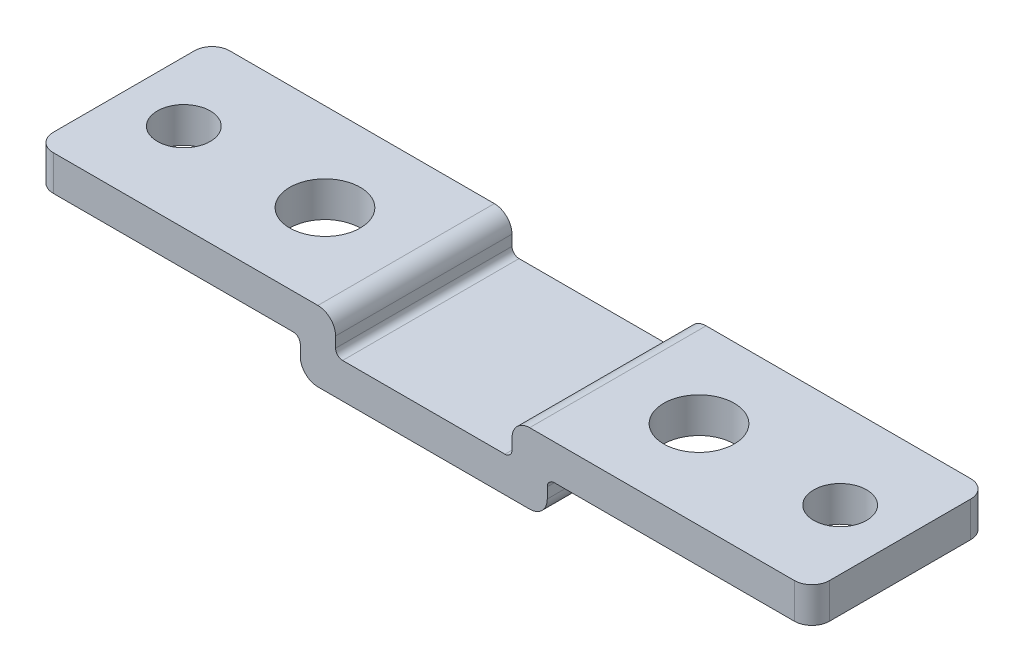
SolidWorks part; units mm, degrees
ref_plane "Plan de face" through (0, 0, 0) normal (0, 0, 1) x (1, 0, 0)
ref_plane "Plan de dessus" through (0, 0, 0) normal (0, 1, 0) x (1, 0, 0)
ref_plane "Plan de droite" through (0, 0, 0) normal (1, 0, 0) x (0, 0, -1)
sketch "Esquisse1" plane through (0, 0, 0) normal (0, 0, 1) x (1, 0, 0)
  line L0 (-13.3273, 2.7875) -> (-16.3273, 2.7875)
  line L1 (-16.8273, 3.2875) -> (-16.8273, 3.5875)
  line L2 (-17.0273, 3.7875) -> (-24.3273, 3.7875)
  line L3 (-24.3273, 3.7875) -> (-24.3273, 4.7875)
  line L4 (-24.3273, 4.7875) -> (-16.3273, 4.7875)
  line L5 (-15.8273, 4.2875) -> (-15.8273, 3.9875)
  line L6 (-15.6273, 3.7875) -> (-13.3273, 3.7875)
  line L7 (-13.3273, 3.7875) -> (-13.3273, 2.7875)
  arc A0 (-15.8273, 3.9875) -> (-15.6273, 3.7875) centre (-15.6273, 3.9875) ccw
  arc A1 (-16.8273, 3.5875) -> (-17.0273, 3.7875) centre (-17.0273, 3.5875) ccw
  arc A2 (-16.3273, 4.7875) -> (-15.8273, 4.2875) centre (-16.3273, 4.2875) cw
  arc A3 (-16.3273, 2.7875) -> (-16.8273, 3.2875) centre (-16.3273, 3.2875) cw
  dimension "D7" = 0.2
  dimension "D8" = 0.2
  dimension "D9" = 0.5
  dimension "D1" = 1
  dimension "D2" = 1
  dimension "D3" = 1
  dimension "D4" = 2.5
  dimension "D5" = 11
  dimension "D6" = 2
extrude "Extrusion1" add sketch "Esquisse1" along normal blind 5
fillet "Congé1" radius 0.5 2 edges at (-24.3273, 4.2875, 5) (-24.3273, 4.2875, 0)
sketch "Esquisse2" plane through (0, 4.7875, 0) normal (0, 1, 0) x (-1, 0, 0)
  line L0 (16.3273, 0) -> (23.8273, 0) construction
  line L1 (13.3273, 5) -> (13.3273, 0) construction
  circle A0 centre (18.6273, 2.5) radius 1
  circle A1 centre (22.6273, 2.5) radius 0.75
  dimension "D1" = 2
  dimension "D4" = 1.5
  dimension "D2" = 2.5
  dimension "D3" = 5.3
  dimension "D5" = 9.3
extrude "Enlèv. mat.-Extru.1" cut sketch "Esquisse2" against normal through all
mirror "Symétrie1" about plane through (-13.3273, 3.7875, 5) normal (-1, 0, 0)
